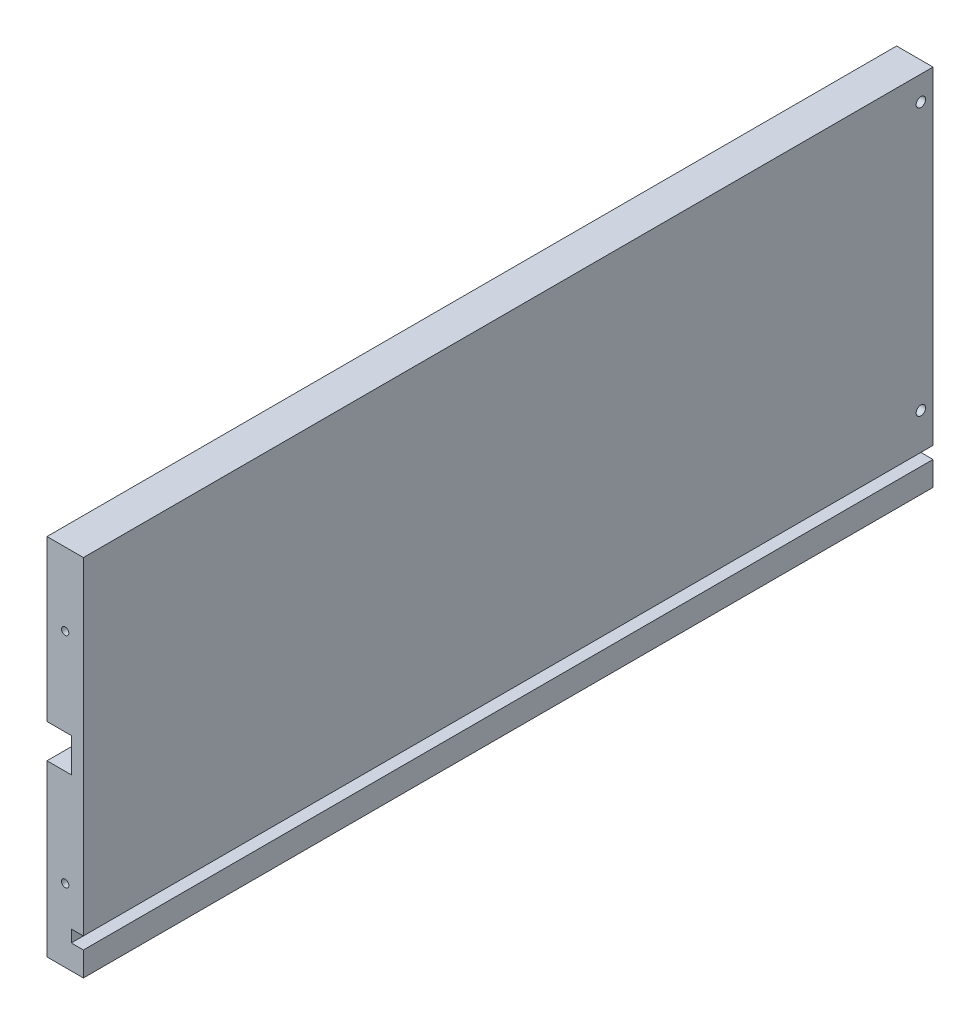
SolidWorks part; units mm, degrees
ref_plane "Front" through (0, 0, 0) normal (0, 0, 1) x (1, 0, 0)
ref_plane "Top" through (0, 0, 0) normal (0, 1, 0) x (1, 0, 0)
ref_plane "Right" through (0, 0, 0) normal (1, 0, 0) x (0, 0, -1)
mirrored part "Drawer_Side_Mirrored"
other "<Drawer_Side>-<M3.0 (3.000000) Diameter Hole1>"
